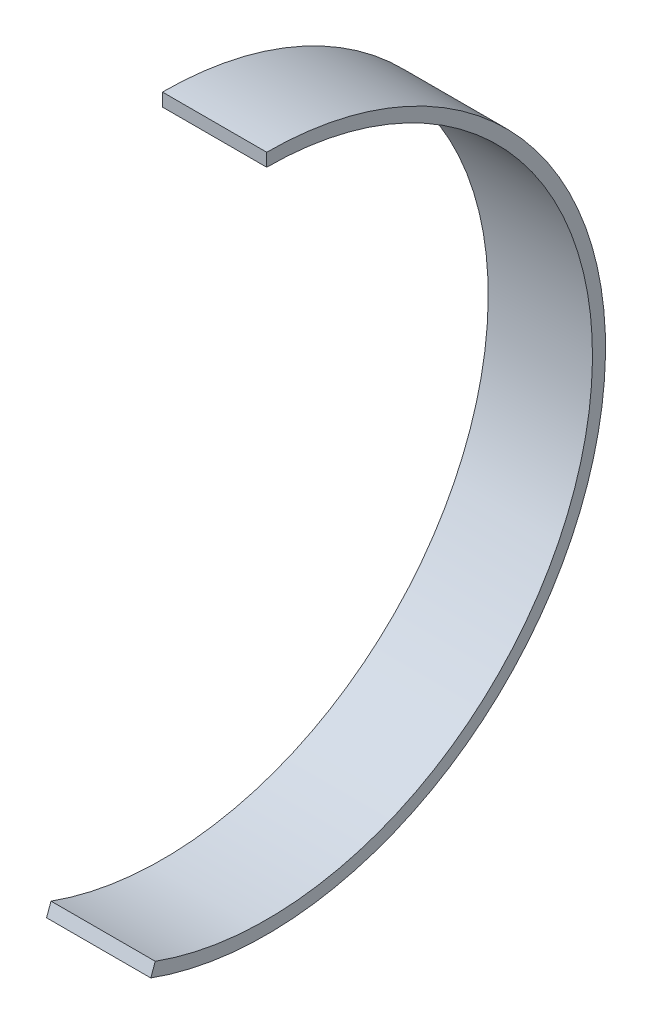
SolidWorks part; units mm, degrees
ref_plane "Plan de face" through (0, 0, 0) normal (0, 0, 1) x (1, 0, 0)
ref_plane "Plan de dessus" through (0, 0, 0) normal (0, 1, 0) x (1, 0, 0)
ref_plane "Plan de droite" through (0, 0, 0) normal (1, 0, 0) x (0, 0, -1)
sketch "Esquisse1" plane through (0, 0, 0) normal (0, 0, 1) x (1, 0, 0)
  line L0 (0, 0) -> (-83.653, 0) construction
  line L1 (0, 0) -> (0, 70.755) construction
  line L2 (-2, 13) -> (2, 13)
  line L3 (-2, 13) -> (-2, 12.5)
  line L4 (-2, 12.5) -> (2, 12.5)
  line L5 (2, 13) -> (2, 12.5)
  dimension "D1" = 4
  dimension "D2" = 0.5
  dimension "D3" = 13
revolve "Révolution1" add sketch "Esquisse1" angle 200 about L0
